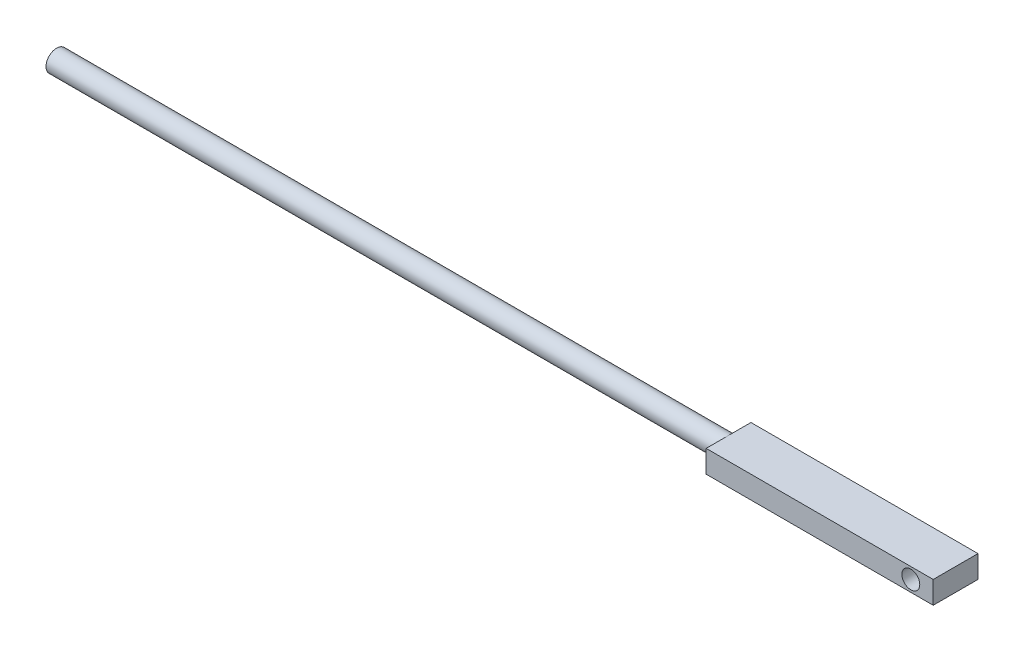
SolidWorks part; units mm, degrees
ref_plane "Ebene vorne" through (0, 0, 0) normal (0, 0, 1) x (1, 0, 0)
ref_plane "Ebene oben" through (0, 0, 0) normal (0, 1, 0) x (1, 0, 0)
ref_plane "Ebene rechts" through (0, 0, 0) normal (1, 0, 0) x (0, 0, -1)
sketch "Skizze1" plane through (0, 0, 0) normal (0, 0, 1) x (1, 0, 0)
  line L1 (0, 0) -> (401.37, 0)
  line L2 (0, 0) -> (0, 10)
  line L3 (0, 10) -> (401.37, 10)
  line L4 (401.37, 0) -> (401.37, 10)
  dimension "D1" = 401.37
  dimension "D2" = 10
extrude "Aufsatz-Linear austragen1" add sketch "Skizze1" along normal blind 20
sketch "Skizze2" plane through (0, 0, 20) normal (0, 0, 1) x (1, 0, 0)
  line L0 (401.37, 0) -> (401.37, 10) construction
  line L1 (401.37, 10) -> (0, 10) construction
  circle A0 centre (391.37, 5) radius 4
  dimension "D1" = 8
  dimension "D2" = 10
  dimension "D3" = 5
extrude "Schnitt-Linear austragen1" cut sketch "Skizze2" against normal through all
sketch "Skizze3" plane through (0, 0, 0) normal (-1, 0, 0) x (0, 0, 1)
  line L0 (20, 0) -> (0, 0) construction
  line L5 (20, 10) -> (20, 0) construction
  circle A0 centre (10, 5) radius 4.75
  dimension "D1" = 9.5
  dimension "D2" = 5
  dimension "D3" = 10
extrude "Schnitt-Linear austragen3" cut sketch "Skizze3" against normal blind 300 flip side to cut
